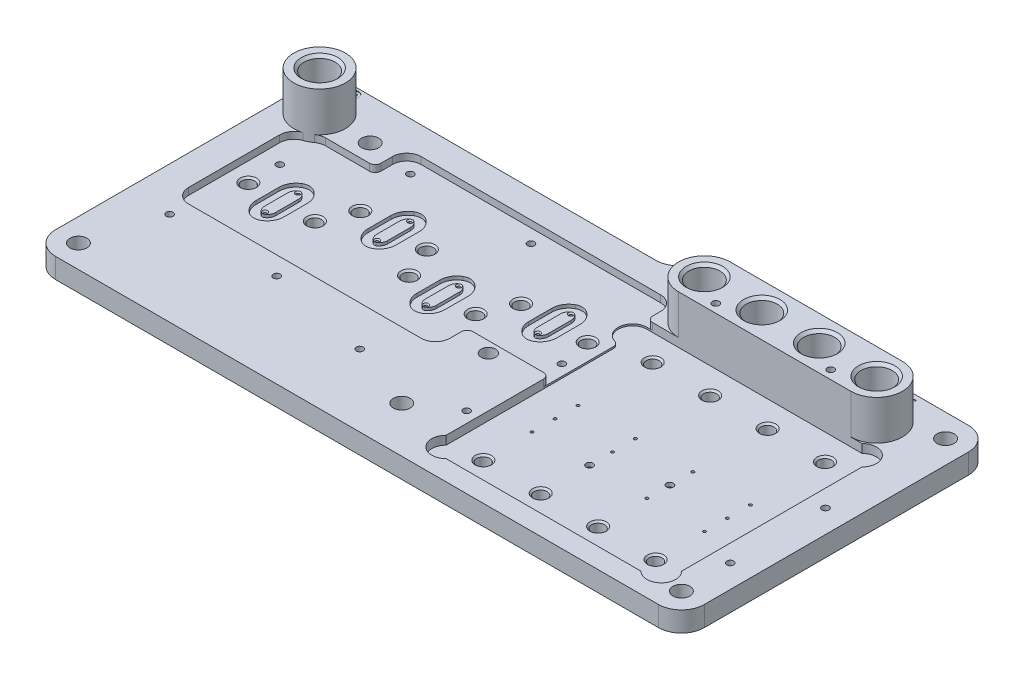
SolidWorks part; units mm, degrees
ref_plane "X_Y" through (0, 0, 0) normal (0, 0, 1) x (1, 0, 0)
ref_plane "Z_X" through (0, 0, 0) normal (0, 1, 0) x (1, 0, 0)
ref_plane "Y_Z" through (0, 0, 0) normal (1, 0, 0) x (0, 0, -1)
ref_plane "X_Y-_6021_master" through (0, 0, 0) normal (0, 0, 1) x (1, 0, 0)
ref_plane "Z_X_peltier-_6021_master" through (0, 0, 0) normal (0, 1, 0) x (1, 0, 0)
ref_plane "Y_Z-_6021_master" through (0, 0, 0) normal (1, 0, 0) x (0, 0, -1)
sketch "zx_sketch-_6021_master" plane through (0, 0, 0) normal (0, 1, 0) x (1, 0, 0)
  line L0 (0, 0) -> (0, 39833.2138) construction
  line L1 (-56.5, 24.66) -> (4, 24.66)
  line L2 (-56.5, 24.66) -> (-56.5, -27)
  line L3 (-56.5, -27) -> (56.5, -27)
  line L4 (56.5, 27) -> (56.5, -27)
  line L5 (0, 0) -> (39833.2138, 0) construction
  line L6 (4, 24.66) -> (4, 27)
  line L11 (4, 27) -> (56.5, 27)
  point P3 (0, -27)
  point P17 (-22.5, 15.66)
  point P18 (22.5, 15.66)
  point P19 (22.5, -15.66)
  point P20 (-22.5, -15.66)
  dimension "D1" = 113
  dimension "D2" = 24.66
  dimension "D3" = 45
  dimension "D4" = 31.32
  dimension "D5" = 27
  dimension "D6" = 2.34
  dimension "D7" = 4
  dimension "D8" = 27
sketch "xy_sketch-_6021_master" plane through (0, 0, 0) normal (0, 0, 1) x (1, 0, 0)
  line L0 (0, 0) -> (0, 5) construction
  line L1 (0, 5) -> (0, 7.3) construction
  dimension "D1" = 5
  dimension "D2" = 2.3
ref_plane "zx_lower_plate-_6021_master" through (0, 5, 0) normal (0, 1, 0) x (1, 0, 0)
ref_plane "zx_sensor-_6021_master" through (0, 7.3, 0) normal (0, 1, 0) x (1, 0, 0)
sketch "zx_sensor_sketch-_6021_master" plane through (0, 7.3, 0) normal (0, 1, 0) x (1, 0, 0)
  line L0 (-42.2, 3.16) -> (-28.2, 8.66) construction
  line L1 (-28.2, 8.66) -> (-14.2, 3.16) construction
  line L2 (-14.2, 3.16) -> (-0.2, 8.66) construction
  line L3 (-42.2, 4.96) -> (-42.2, -0.8) construction
  line L4 (-28.2, 10.46) -> (-28.2, 4.7) construction
  line L5 (-14.2, 4.96) -> (-14.2, -0.8) construction
  line L6 (-0.2, 10.46) -> (-0.2, 4.7) construction
  line L7 (-42.2, 3.16) -> (-42.2, -0.8) construction
  line L8 (-28.2, 8.66) -> (-28.2, 4.7) construction
  line L9 (-14.2, 3.16) -> (-14.2, -0.8) construction
  line L10 (-0.2, 8.66) -> (-0.2, 4.7) construction
  line L11 (-39.215, 3.16) -> (-45.185, 3.16) construction
  line L12 (-39.215, 7.475) -> (-39.215, -1.155) construction
  line L13 (-44.615, 3.16) -> (-39.785, 3.16) construction
  point P8 (-42.2, 2.08)
  point P16 (-42.2, 3.16)
  point P19 (-39.215, 3.16)
  point P22 (-42.2, 3.16)
  dimension "D3" = 14
  dimension "D4" = 1.08
  dimension "D6" = 5.76
  dimension "D7" = 5.97
  dimension "D9" = 8.63
  dimension "D10" = 4.83
  dimension "D11" = 5.5
sketch "zx_valve_sketch-_6021_master" plane through (0, 8.2, 0) normal (0, 1, 0) x (1, 0, 0)
  line L0 (44, -4.25) -> (34, -4.25) construction
  line L1 (34, -4.25) -> (24, -4.25) construction
  line L2 (24, -4.25) -> (14, -4.25) construction
  line L3 (44, -10.5) -> (44, -6.5) construction
  line L4 (44, -6.5) -> (44, -2.5) construction
  line L5 (34, -2.5) -> (34, -6.5) construction
  line L6 (34, -6.5) -> (34, -10.5) construction
  line L7 (24, -2.5) -> (24, -6.5) construction
  line L8 (24, -6.5) -> (24, -10.5) construction
  line L9 (14, -2.5) -> (14, -6.5) construction
  line L10 (14, -6.5) -> (14, -10.5) construction
  line L11 (44, 10.5) -> (44, -19) construction
  line L12 (34, 10.5) -> (34, -19) construction
  line L14 (24, -19) -> (24, 10.5) construction
  line L17 (14, 10.5) -> (14, -19) construction
  point P20 (44, -4.25)
  dimension "D1" = 10
  dimension "D4" = 8
  dimension "D5" = 2.25
  dimension "D6" = 29.5
sketch "zx_manifold_sketch-_6021_master" plane through (0, 5, 0) normal (0, 1, 0) x (1, 0, 0)
  line L0 (-34.0003, 7.58) -> (-22.3997, 7.58) construction
  line L4 (44, 19.5) -> (34, 19.5) construction
  line L5 (34, 19.5) -> (24, 19.5) construction
  line L6 (24, 19.5) -> (14, 19.5) construction
  line L7 (39, 10.5) -> (39, -7.6132)
  line L9 (-48.0003, 2.08) -> (-36.3997, 2.08) construction
  line L11 (-20.0003, 2.08) -> (-8.3997, 2.08) construction
  line L12 (-6.0003, 7.58) -> (5.6003, 7.58) construction
  line L13 (-48.9, -6.72) -> (-2.2958, -6.72)
  line L15 (14, -6.5) -> (24, -6.5)
  line L17 (-14.2, 4.96) -> (-9.7626, 10.5608)
  line L22 (34, -4.7265) -> (44, -4.7265) construction
  line L23 (44, -4.7265) -> (39, -7.6132) construction
  line L24 (-4.2467, 12.0482) -> (-0.2, 10.46)
  line L26 (44, 22) -> (14, 22)
  line L28 (-48.9, -14.72) -> (-30.3969, -14.72)
  line L30 (10.8896, -9.015) -> (7.7791, -11.53) construction
  line L31 (34, -14.5) -> (45, -14.5)
  line L32 (-22.5, -24) -> (44, -24)
  line L35 (-14.2, -0.8) -> (-18.2467, -2.3882)
  line L38 (-52.7667, 2.6469) -> (-51, 17.5)
  line L39 (-28.2, 4.7) -> (-23.7626, -0.9008)
  line L40 (14, 10.5) -> (22.5, 15.66) construction
  line L43 (49, -19) -> (49, -18.5)
  line L45 (-32.2467, 12.0482) -> (-28.2, 10.46)
  line L46 (-37.7626, 10.5608) -> (-42.2, 4.96)
  line L47 (-42.2, -0.8) -> (-46.2467, -2.3882)
  line L48 (-0.2, 4.7) -> (10.8896, -9.015)
  circle A0 centre (34, 19.5) radius 3.85 construction
  circle A1 centre (44, 19.5) radius 3.85 construction
  circle A2 centre (24, 19.5) radius 3.85 construction
  circle A3 centre (14, 19.5) radius 3.85 construction
  arc A4 (34, -10.5) -> (39, -7.6132) centre (34, -4.7265) ccw
  arc A6 (29, 10.5) -> (34, -2.5) centre (48.4, 10.5) ccw
  arc A7 (44, -10.5) -> (39, -7.6132) centre (44, -4.7265) cw
  arc A8 (44, -2.5) -> (49, 10.5) centre (29.6, 10.5) ccw
  arc A11 (45.3208, 21.6226) -> (44, 22) centre (44, 19.5) ccw
  arc A12 (44, -6.5) -> (51.5, 10.5) centre (28.4833, 10.5) ccw
  arc A13 (14, 22) -> (11.6636, 20.3896) centre (14, 19.5) ccw
  arc A15 (34, -14.5) -> (34, -6.5) centre (34, -10.5) cw
  arc A16 (-48.9, -6.72) -> (-48.9, -14.72) centre (-48.9, -10.72) ccw
  arc A17 (44, -24) -> (49, -19) centre (44, -19) ccw
  arc A18 (-22.5, -24) -> (-26.4485, -19.36) centre (-22.5, -20) cw
  arc A19 (-30.3969, -14.72) -> (-26.4485, -19.36) centre (-30.3969, -18.72) cw
  arc A20 (14, -10.5) -> (10.8896, -9.015) centre (14, -6.5) cw
  arc A21 (-4.2467, 12.0482) -> (-9.7626, 10.5608) centre (-6.0003, 7.58) ccw
  circle A22 centre (-51, 17.5) radius 3.85 construction
  arc A23 (-23.7626, -0.9008) -> (-18.2467, -2.3882) centre (-20.0003, 2.08) ccw
  arc A24 (-32.2467, 12.0482) -> (-37.7626, 10.5608) centre (-34.0003, 7.58) ccw
  arc A25 (-46.2467, -2.3882) -> (-52.7667, 2.6469) centre (-48.0003, 2.08) cw
  arc A26 (49, -18.5) -> (45, -14.5) centre (45, -18.5) ccw
  circle A27 centre (-51, 17.5) radius 5.5 construction
  arc A29 (14, 19.5) -> (19, 10.5) centre (8.4, 10.5) cw
  arc A30 (39, 10.5) -> (34, 19.5) centre (28.4, 10.5) ccw
  arc A31 (49, 10.5) -> (44, 19.5) centre (38.4, 10.5) ccw
  arc A32 (29, 10.5) -> (24, 19.5) centre (18.4, 10.5) ccw
  arc A33 (19, 10.5) -> (24, -2.5) centre (38.4, 10.5) ccw
  arc A35 (45.3208, 21.6226) -> (51.5, 10.5) centre (38.4, 10.5) cw
  arc A36 (14, -2.5) -> (11.6636, 20.3896) centre (35.6147, 11.2703) cw
  arc A37 (19.5172, -12.2931) -> (7.7791, -11.53) centre (14, -6.5) cw
  arc A38 (7.7791, -11.53) -> (-2.2958, -6.72) centre (-2.2958, -19.6763) ccw
  arc A39 (24, -10.5) -> (19.5172, -12.2931) centre (24, -17) ccw
  point P121 (-42.2, 2.08)
  dimension "D1" = 30
  dimension "D2" = 7.7
  dimension "D4" = 2.5
  dimension "D5" = 4
  dimension "D6" = 92.9
  dimension "D9" = 4
  dimension "D15" = 4
  dimension "D18" = 4.8
  dimension "D11" = 4
sketch "zx_screws_sketch-_6021_master" plane through (0, 5, 0) normal (0, 1, 0) x (1, 0, 0)
  line L4 (-34.0003, 7.58) -> (-22.3997, 7.58) construction
  line L5 (-20.0003, 2.08) -> (-8.3997, 2.08) construction
  line L6 (-6.0003, 7.58) -> (5.6003, 7.58) construction
  line L7 (-36.3997, 2.08) -> (-48.0003, 2.08) construction
  line L13 (56.5, 27) -> (56.5, -27) construction
  circle A0 centre (52.5, 23) radius 4 construction
  circle A3 centre (52.5, -23) radius 4 construction
  arc A7 (-52.7667, 2.6469) -> (-46.2467, -2.3882) centre (-48.0003, 2.08) ccw construction
  circle A8 centre (-52.5, -23) radius 4 construction
  point P0 (-0.2, -19)
  point P1 (52.5, -23)
  point P2 (52.5, 23)
  point P3 (6.6, 23)
  point P4 (-52.5, -23)
  point P5 (-42.2, 17.5)
ref_plane "yz_sensor-_6021_master" through (-42.2, 0, 0) normal (1, 0, 0) x (0, 0, -1)
ref_plane "zx_valve-_6021_master" through (0, 8.2, 0) normal (0, 1, 0) x (1, 0, 0)
ref_plane "zx_sensor_shelf-_6021_master" through (0, 9.691, 0) normal (0, 1, 0) x (1, 0, 0)
sketch "xz_cover-_6021_master" plane through (0, 0, 0) normal (0, 1, 0) x (1, 0, 0)
  line L1 (-63, -36.79) -> (63, -36.79)
  line L2 (-71.85, -27.94) -> (-71.85, 30.02)
  line L3 (-71.85, 30.02) -> (71.85, 30.02)
  line L4 (71.85, -27.94) -> (71.85, 30.02)
  line L5 (-71.85, -36.79) -> (71.85, 30.02) construction
  line L6 (-71.85, 30.02) -> (71.85, -36.79) construction
  line L7 (0, -1003.385) -> (0, 48996.615) construction
  arc A0 (71.85, -27.94) -> (63, -36.79) centre (63, -27.94) cw
  arc A1 (-63, -36.79) -> (-71.85, -27.94) centre (-63, -27.94) cw
  circle A2 centre (-64.495, 5.21) radius 3.6
  circle A3 centre (64.495, 5.21) radius 3.6
  point P0 (0, -3.385)
  dimension "D4" = 8.85
  dimension "D5" = 42
  dimension "D7" = 7.2
  dimension "D1" = 66.81
  dimension "D2" = 143.7
  dimension "D6" = 128.99
inserted part "_6021_master"
sketch "Sketch7" plane through (0, 5, 0) normal (0, 1, 0) x (1, 0, 0)
  line L0 (-56.5, -27) -> (56.5, -27) construction
  line L1 (56.5, 27) -> (56.5, -27) construction
  line L2 (4, 27) -> (56.5, 27) construction
  line L3 (4, 24.66) -> (4, 27) construction
  line L4 (-56.5, 24.66) -> (4, 24.66) construction
  line L5 (-56.5, 24.66) -> (-56.5, -27) construction
  line L6 (-56.5, -27) -> (56.5, -27)
  line L7 (56.5, 27) -> (56.5, -27)
  line L8 (4, 27) -> (56.5, 27)
  line L9 (4, 24.66) -> (4, 27)
  line L10 (-56.5, 24.66) -> (4, 24.66)
  line L11 (-56.5, 24.66) -> (-56.5, -27)
  circle A0 centre (-42.2, 4.96) radius 0.25
  circle A1 centre (-42.2, -0.8) radius 0.25
  circle A2 centre (-28.2, 10.46) radius 0.25
  circle A3 centre (-28.2, 4.7) radius 0.25
  circle A4 centre (-14.2, 4.96) radius 0.25
  circle A5 centre (-14.2, -0.8) radius 0.25
  circle A6 centre (-0.2, 10.46) radius 0.25
  circle A7 centre (-0.2, 4.7) radius 0.25
  circle A8 centre (14, -2.5) radius 0.25
  circle A9 centre (14, -6.5) radius 0.25
  circle A10 centre (14, -10.5) radius 0.25
  circle A11 centre (24, -2.5) radius 0.25
  circle A12 centre (24, -6.5) radius 0.25
  circle A13 centre (24, -10.5) radius 0.6
  circle A14 centre (34, -2.5) radius 0.25
  circle A15 centre (34, -6.5) radius 0.6
  circle A16 centre (34, -10.5) radius 0.25
  circle A17 centre (44, -2.5) radius 0.25
  circle A18 centre (44, -6.5) radius 0.25
  circle A19 centre (44, -10.5) radius 0.25
  circle A20 centre (-51, 17.5) radius 0.25
  circle A21 centre (14, 19.5) radius 0.25
  circle A22 centre (24, 19.5) radius 0.25
  circle A23 centre (34, 19.5) radius 0.25
  circle A24 centre (44, 19.5) radius 0.25
  dimension "D1" = 0.5
  dimension "D2" = 0.5
  dimension "D3" = 1.2
extrude "Boss-Extrude1" add sketch "Sketch7" along normal up to surface (2.3 mm away)
sketch "Sketch8" plane through (0, 7.3, 0) normal (0, 1, 0) x (1, 0, 0)
  line L2 (14, 24) -> (44, 24)
  line L3 (14, 15) -> (44, 15)
  circle A0 centre (-51, 17.5) radius 4.5
  arc A1 (14, 24) -> (14, 15) centre (14, 19.5) ccw
  arc A2 (44, 24) -> (44, 15) centre (44, 19.5) cw
  circle A3 centre (44, 19.5) radius 0.25 construction
  circle A4 centre (34, 19.5) radius 0.25 construction
  circle A5 centre (24, 19.5) radius 0.25 construction
  circle A6 centre (14, 19.5) radius 0.25 construction
  circle A7 centre (-51, 17.5) radius 0.25 construction
  circle A8 centre (44, 19.5) radius 0.25
  circle A9 centre (34, 19.5) radius 0.25
  circle A10 centre (24, 19.5) radius 0.25
  circle A11 centre (14, 19.5) radius 0.25
  circle A12 centre (-51, 17.5) radius 0.25
  dimension "D1" = 9
extrude "Boss-Extrude2" add sketch "Sketch8" along normal blind 8.1
sketch "Sketch17" plane through (0, 7.3, 0) normal (0, 1, 0) x (1, 0, 0)
  line L0 (-34.0003, 7.58) -> (-22.3997, 7.58) construction
  line L1 (8.5, 15) -> (49.5, 15)
  line L2 (8.5, -2.02) -> (8.5, -23.5)
  line L3 (8.5, -23.5) -> (49.5, -23.5)
  line L4 (49.5, 15) -> (49.5, -23.5)
  line L5 (-5.8, -7.52) -> (-51.3003, -7.52)
  line L6 (-51.3003, -7.52) -> (-51.3003, 14.38)
  line L7 (-51.3003, 14.38) -> (-38.2, 14.38)
  line L8 (-38.2, 14.38) -> (-38.2, 19.88)
  line L9 (-38.2, 19.88) -> (8.5, 19.88)
  line L10 (-48.0003, 2.08) -> (-36.3997, 2.08) construction
  line L11 (34, -4.25) -> (24, -4.25) construction
  line L12 (-5.8, -7.52) -> (-5.8, -2.02)
  line L13 (-5.8, -2.02) -> (8.5, -2.02)
  line L15 (-20.0003, 2.08) -> (-8.3997, 2.08) construction
  line L16 (4, 24.66) -> (-56.5, 24.66)
  line L17 (-56.5, 24.66) -> (-56.5, -27)
  line L18 (-56.5, -27) -> (56.5, -27)
  line L19 (56.5, -27) -> (56.5, 27)
  line L20 (56.5, 27) -> (4, 27)
  line L21 (4, 27) -> (4, 24.66)
  line L22 (4, 24.66) -> (-56.5, 24.66)
  line L23 (-56.5, 24.66) -> (-56.5, -27)
  line L24 (-56.5, -27) -> (56.5, -27)
  line L25 (56.5, -27) -> (56.5, 27)
  line L26 (56.5, 27) -> (4, 27)
  line L27 (4, 27) -> (4, 24.66)
  line L28 (-36.3997, 2.08) -> (-36.3997, 7.58) construction
  line L30 (8.5, 19.88) -> (8.5, 15)
  line L31 (14, 15) -> (44, 15) construction
  circle A0 centre (44, -2.5) radius 0.25 construction
  circle A1 centre (34, -2.5) radius 0.25 construction
  circle A2 centre (24, -2.5) radius 0.25 construction
  circle A3 centre (14, -2.5) radius 0.25 construction
  circle A4 centre (44, -2.5) radius 0.25
  circle A5 centre (34, -2.5) radius 0.25
  circle A6 centre (24, -2.5) radius 0.25
  circle A7 centre (14, -2.5) radius 0.25
  circle A8 centre (44, -6.5) radius 0.25 construction
  circle A9 centre (34, -6.5) radius 0.6 construction
  circle A10 centre (24, -6.5) radius 0.25 construction
  circle A11 centre (14, -6.5) radius 0.25 construction
  circle A12 centre (44, -6.5) radius 0.25
  circle A13 centre (34, -6.5) radius 0.6
  circle A14 centre (24, -6.5) radius 0.25
  circle A15 centre (14, -6.5) radius 0.25
  circle A16 centre (44, -10.5) radius 0.25 construction
  circle A17 centre (34, -10.5) radius 0.25 construction
  circle A18 centre (24, -10.5) radius 0.6 construction
  circle A19 centre (14, -10.5) radius 0.25 construction
  circle A20 centre (44, -10.5) radius 0.25
  circle A21 centre (34, -10.5) radius 0.25
  circle A22 centre (24, -10.5) radius 0.6
  circle A23 centre (14, -10.5) radius 0.25
  circle A27 centre (44, 19.5) radius 0.25 construction
  circle A28 centre (34, 19.5) radius 0.25 construction
  circle A29 centre (24, 19.5) radius 0.25 construction
  circle A30 centre (14, 19.5) radius 0.25 construction
  circle A31 centre (-51, 17.5) radius 0.25 construction
  circle A32 centre (44, 19.5) radius 0.25
  circle A33 centre (34, 19.5) radius 0.25
  circle A34 centre (24, 19.5) radius 0.25
  circle A35 centre (14, 19.5) radius 0.25
  circle A36 centre (-51, 17.5) radius 0.25
  point P51 (29, -23.5)
  point P60 (29, -4.25)
  point P64 (49.5, -4.25)
  point P65 (-28.2, 7.58)
  point P71 (-14.2, 2.08)
  dimension "D1" = 38.5
  dimension "D2" = 41
  dimension "D3" = 0
  dimension "D5" = 9.6
  dimension "D6" = 12.3
  dimension "D7" = 3.3
  dimension "D8" = 10
  dimension "D10" = 8.4
extrude "Boss-Extrude3" add sketch "Sketch17" along normal blind 1.2 contours L8 L9 L1 L4 L3 L2 L5 L6 L7 M8 M3 M4 M5 M6 M7 M31 M32 M33 M29
hole_wizard "1/4-28 Tapped Hole1" positions "Sketch9" profile "Sketch10" tap size "1/4-28" standard "ANSI Inch"
sketch "Sketch9" plane through (0, 15.4, 0) normal (0, 1, 0) x (1, 0, 0)
  point P0 (-51, 17.5)
  point P3 (14, 19.5)
  point P6 (24, 19.5)
  point P9 (34, 19.5)
  point P12 (44, 19.5)
sketch "Sketch10" plane through (-51, 15.4, -17.5) normal (1, 0, 0) x (0, 0, 1)
  line L0 (0, 0) -> (0, 8.89)
  line L1 (0, 8.89) -> (2.7051, 8.89)
  line L2 (2.7051, 8.89) -> (2.7051, 0.4699)
  line L3 (2.7051, 0.4699) -> (3.175, 0)
  line L5 (3.175, 0) -> (0, 0)
  line L6 (-2.7051, 0.4699) -> (-3.175, 0) construction
  line L10 (0, 8.89) -> (-2.7051, 8.89) construction
  line L11 (0, -6.35) -> (0, 107.95) construction
  dimension "Tap Drill Dia." = 5.4102
  dimension "Tap Drill Depth" = 8.89
  dimension "Near C'Sink Dia." = 6.35
  dimension "Near C'Sink Angle" = 90
  dimension "Drill Angle" = 180
sketch "Sketch29" plane through (0, 7.3, 0) normal (0, 1, 0) x (1, 0, 0)
  line L0 (8.5, -2.02) -> (8.5, -23.5) construction
  line L1 (8.5, -23.5) -> (49.5, -23.5) construction
  line L2 (49.5, 15) -> (49.5, -23.5) construction
  line L3 (8.5, 15) -> (49.5, 15) construction
  line L4 (8.5, 15) -> (8.5, -23.5)
  line L5 (8.5, -23.5) -> (49.5, -23.5)
  line L6 (49.5, 15) -> (49.5, -23.5)
  line L7 (8.5, 15) -> (49.5, 15)
extrude "Cut-Extrude1" cut sketch "Sketch29" against normal blind 0.3
hole_wizard "#4 (0.209) Diameter Hole1" positions "Sketch11" profile "Sketch12" hole size "#4" standard "ANSI Inch"
sketch "Sketch11" plane through (0, 8.5, 0) normal (0, 1, 0) x (1, 0, 0)
  point P0 (-42.2, 17.5)
  point P3 (-52.5, -23)
  point P6 (-0.2, -19)
  point P9 (6.6, 23)
  point P12 (52.5, 23)
  point P15 (52.5, -23)
sketch "Sketch12" plane through (-42.2, 8.5, -17.5) normal (1, 0, 0) x (0, 0, 1)
  line L0 (0, 0) -> (0, 3.5)
  line L1 (0, 3.5) -> (1.4732, 3.5)
  line L2 (1.4732, 3.5) -> (1.4732, 0)
  line L5 (1.4732, 0) -> (0, 0)
  line L11 (0, -6.35) -> (0, 107.95) construction
  dimension "Thru Hole Dia." = 2.9464
  dimension "Thru Hole Depth" = 3.5
hole_wizard "#4-40 Tapped Hole1" positions "Sketch13" profile "Sketch14" tap size "#4-40" standard "ANSI Inch"
sketch "Sketch13" plane through (0, 7.3, 0) normal (0, 1, 0) x (1, 0, 0)
  point P0 (-48.0003, 2.08)
  point P3 (-36.3997, 2.08)
  point P6 (-34.0003, 7.58)
  point P9 (-22.3997, 7.58)
  point P12 (-20.0003, 2.08)
  point P15 (-8.3997, 2.08)
  point P18 (-6.0003, 7.58)
  point P21 (5.6003, 7.58)
sketch "Sketch14" plane through (-48.0003, 7.3, -2.08) normal (1, 0, 0) x (0, 0, 1)
  line L0 (0, 0) -> (0, 2.3)
  line L1 (0, 2.3) -> (1.1303, 2.3)
  line L2 (1.1303, 2.3) -> (1.1303, 0.2921)
  line L3 (1.1303, 0.2921) -> (1.4224, 0)
  line L5 (1.4224, 0) -> (0, 0)
  line L6 (-1.1303, 0.2921) -> (-1.4224, 0) construction
  line L11 (0, -6.35) -> (0, 107.95) construction
  dimension "Thru Tap Drill Dia." = 2.2606
  dimension "Thru Tap Drill Depth" = 2.3
  dimension "Near C'Sink Dia." = 2.8448
  dimension "Near C'Sink Angle" = 90
hole_wizard "#4-40 Tapped Hole2" positions "Sketch18" profile "Sketch19" tap size "#4-40" standard "ANSI Inch"
sketch "Sketch18" plane through (0, 7, 0) normal (0, 1, 0) x (1, 0, 0)
  point P0 (14, 10.5)
  point P3 (24, 10.5)
  point P6 (34, 10.5)
  point P9 (44, 10.5)
  point P12 (14, -19)
  point P15 (24, -19)
  point P18 (34, -19)
  point P21 (44, -19)
sketch "Sketch19" plane through (14, 7, -10.5) normal (1, 0, 0) x (0, 0, 1)
  line L0 (0, 0) -> (0, 2)
  line L1 (0, 2) -> (1.1303, 2)
  line L2 (1.1303, 2) -> (1.1303, 0.2921)
  line L3 (1.1303, 0.2921) -> (1.4224, 0)
  line L5 (1.4224, 0) -> (0, 0)
  line L6 (-1.1303, 0.2921) -> (-1.4224, 0) construction
  line L11 (0, -6.35) -> (0, 107.95) construction
  dimension "Thru Tap Drill Dia." = 2.2606
  dimension "Thru Tap Drill Depth" = 2
  dimension "Near C'Sink Dia." = 2.8448
  dimension "Near C'Sink Angle" = 90
sketch "Sketch15" plane through (0, 7.3, 0) normal (0, 1, 0) x (1, 0, 0)
  line L1 (-42.2, 4.96) -> (-42.2, -0.8) construction
  line L2 (-46.025, 2.08) -> (-45.0281, 2.08) construction
  line L7 (-41.25, 4.094) -> (-41.25, 0.066)
  line L8 (-43.15, 4.094) -> (-43.15, 0.066)
  line L9 (-42.7, 4.094) -> (-42.2, 4.96) construction
  line L10 (-42.2, 4.96) -> (-42.45, 4.96) construction
  arc A0 (-42.425, 5.3497) -> (-41.975, 5.3497) centre (-42.2, 4.96) cw
  circle A1 centre (-42.2, 4.96) radius 0.25 construction
  arc A2 (-42.425, 5.3497) -> (-43.15, 4.094) centre (-41.7, 4.094) ccw
  arc A3 (-41.975, 5.3497) -> (-41.25, 4.094) centre (-42.7, 4.094) cw
  arc A4 (-41.975, -1.1897) -> (-41.25, 0.066) centre (-42.7, 0.066) ccw
  arc A5 (-42.425, -1.1897) -> (-43.15, 0.066) centre (-41.7, 0.066) cw
  arc A6 (-42.425, -1.1897) -> (-41.975, -1.1897) centre (-42.2, -0.8) ccw
  point P12 (-42.2, 2.08)
  dimension "D1" = 1.9
  dimension "D3" = 0.2
  dimension "D2" = 60
extrude "flowcell_cut" cut sketch "Sketch15" against normal blind 0.1
chamfer "Chamfer1" distance 0.2 angle 45 2 edges at (-42.2, 7.2, 0.55) (-42.2, 7.2, -5.21)
sketch "Sketch16" plane through (0, 7.3, 0) normal (0, 1, 0) x (1, 0, 0)
  line L2 (-41.25, 0.066) -> (-41.25, 4.094)
  line L3 (-43.15, 4.094) -> (-43.15, 0.066)
  line L8 (-41.25, 0.066) -> (-41.25, 4.094)
  line L9 (-43.15, 4.094) -> (-43.15, 0.066)
  line L64 (-39.75, 0.066) -> (-39.75, 4.094)
  line L65 (-44.65, 4.094) -> (-44.65, 0.066)
  line L66 (-39.75, 0.066) -> (-39.75, 4.094)
  line L67 (-44.65, 4.094) -> (-44.65, 0.066)
  arc A6 (-41.25, 4.094) -> (-41.975, 5.3497) centre (-42.7, 4.094) ccw
  arc A7 (-41.975, -1.1897) -> (-41.25, 0.066) centre (-42.7, 0.066) ccw
  arc A8 (-42.425, -1.1897) -> (-41.975, -1.1897) centre (-42.2, -0.8) ccw
  arc A9 (-43.15, 0.066) -> (-42.425, -1.1897) centre (-41.7, 0.066) ccw
  arc A10 (-42.425, 5.3497) -> (-43.15, 4.094) centre (-41.7, 4.094) ccw
  arc A11 (-42.425, -1.1897) -> (-41.975, -1.1897) centre (-42.2, -0.8) ccw
  arc A24 (-41.25, 4.094) -> (-41.975, 5.3497) centre (-42.7, 4.094) ccw
  arc A25 (-41.975, -1.1897) -> (-41.25, 0.066) centre (-42.7, 0.066) ccw
  arc A27 (-43.15, 0.066) -> (-42.425, -1.1897) centre (-41.7, 0.066) ccw
  arc A28 (-42.425, 5.3497) -> (-43.15, 4.094) centre (-41.7, 4.094) ccw
  arc A30 (-39.75, 4.094) -> (-41.225, 6.6487) centre (-42.7, 4.094) ccw
  arc A31 (-41.225, -2.4887) -> (-39.75, 0.066) centre (-42.7, 0.066) ccw
  arc A32 (-43.175, -2.4887) -> (-41.225, -2.4887) centre (-42.2, -0.8) ccw
  arc A33 (-44.65, 0.066) -> (-43.175, -2.4887) centre (-41.7, 0.066) ccw
  arc A34 (-43.175, 6.6487) -> (-44.65, 4.094) centre (-41.7, 4.094) ccw
  arc A35 (-43.175, -2.4887) -> (-41.225, -2.4887) centre (-42.2, -0.8) ccw
  arc A36 (-39.75, 4.094) -> (-41.225, 6.6487) centre (-42.7, 4.094) ccw
  arc A37 (-41.225, -2.4887) -> (-39.75, 0.066) centre (-42.7, 0.066) ccw
  arc A39 (-44.65, 0.066) -> (-43.175, -2.4887) centre (-41.7, 0.066) ccw
  arc A40 (-43.175, 6.6487) -> (-44.65, 4.094) centre (-41.7, 4.094) ccw
  arc A44 (-41.225, 6.6487) -> (-43.175, 6.6487) centre (-42.2, 4.96) ccw
  arc A45 (-41.225, 6.6487) -> (-43.175, 6.6487) centre (-42.2, 4.96) ccw
  arc A46 (-41.975, 5.3497) -> (-42.425, 5.3497) centre (-42.2, 4.96) ccw
  arc A47 (-41.975, 5.3497) -> (-42.425, 5.3497) centre (-42.2, 4.96) ccw
  dimension "D2" = 0
  dimension "D4" = 1.5
extrude "gland_cut" cut sketch "Sketch16" against normal blind 0.6
pattern_linear "LPattern17" count 4 spacing 14 along (1, 0, 0) count 2 spacing 5.5 of "gland_cut", "flowcell_cut"
pattern_linear "LPattern19" count 4 spacing 14 along (1, 0, 0) count 2 spacing 5.5 of "Chamfer1"
sketch "Sketch20" plane through (0, 5, 0) normal (0, -1, 0) x (1, 0, 0)
  line L2 (10.6952, 9.1722) -> (-0.3944, -4.5428)
  line L3 (10.6952, 9.1722) -> (-0.3944, -4.5428)
  line L4 (-42.396, -5.1152) -> (-37.9586, -10.716)
  line L5 (-32.1553, -12.2809) -> (-28.1087, -10.6927)
  line L6 (-42.396, -5.1152) -> (-37.9586, -10.716)
  line L7 (-32.1553, -12.2809) -> (-28.1087, -10.6927)
  line L8 (-42.004, -4.8048) -> (-37.5667, -10.4055)
  line L9 (-32.338, -11.8155) -> (-28.2913, -10.2273)
  line L10 (-42.004, -4.8048) -> (-37.5667, -10.4055)
  line L11 (-32.338, -11.8155) -> (-28.2913, -10.2273)
  line L12 (11.084, 8.8578) -> (-0.0056, -4.8572)
  line L13 (11.084, 8.8578) -> (-0.0056, -4.8572)
  line L14 (-18.338, 2.1555) -> (-14.2913, 0.5673)
  line L15 (-28.004, -4.8552) -> (-23.5667, 0.7455)
  line L16 (-18.338, 2.1555) -> (-14.2913, 0.5673)
  line L17 (-28.004, -4.8552) -> (-23.5667, 0.7455)
  line L18 (-18.1553, 2.6209) -> (-14.1087, 1.0327)
  line L19 (-28.396, -4.5448) -> (-23.9586, 1.056)
  line L20 (-18.1553, 2.6209) -> (-14.1087, 1.0327)
  line L21 (-28.396, -4.5448) -> (-23.9586, 1.056)
  line L23 (-42.396, -5.1152) -> (-42.004, -4.8048)
  line L24 (-4.1553, -12.2809) -> (-0.1087, -10.6927)
  line L25 (-14.396, -5.1152) -> (-9.9586, -10.716)
  line L26 (-4.1553, -12.2809) -> (-0.1087, -10.6927)
  line L27 (-14.396, -5.1152) -> (-9.9586, -10.716)
  line L28 (-4.338, -11.8155) -> (-0.2913, -10.2273)
  line L29 (-14.004, -4.8048) -> (-9.5667, -10.4055)
  line L30 (-4.338, -11.8155) -> (-0.2913, -10.2273)
  line L31 (-14.004, -4.8048) -> (-9.5667, -10.4055)
  line L36 (-28.1087, -10.6927) -> (-28.2913, -10.2273)
  line L37 (-28.004, -4.8552) -> (-28.396, -4.5448)
  line L38 (-14.2913, 0.5673) -> (-14.1087, 1.0327)
  line L39 (-14.396, -5.1152) -> (-14.004, -4.8048)
  line L40 (-0.1087, -10.6927) -> (-0.2913, -10.2273)
  line L41 (-0.0056, -4.8572) -> (-0.3944, -4.5428)
  line L42 (14, 10.25) -> (14, 10.75)
  arc A2 (-37.9586, -10.716) -> (-32.1553, -12.2809) centre (-34.0003, -7.58) ccw
  arc A3 (-37.9586, -10.716) -> (-32.1553, -12.2809) centre (-34.0003, -7.58) ccw
  arc A4 (-37.5667, -10.4055) -> (-32.338, -11.8155) centre (-34.0003, -7.58) ccw
  arc A5 (-37.5667, -10.4055) -> (-32.338, -11.8155) centre (-34.0003, -7.58) ccw
  arc A7 (-18.338, 2.1555) -> (-23.5667, 0.7455) centre (-20.0003, -2.08) ccw
  arc A8 (-18.338, 2.1555) -> (-23.5667, 0.7455) centre (-20.0003, -2.08) ccw
  arc A9 (-18.1553, 2.6209) -> (-23.9586, 1.056) centre (-20.0003, -2.08) ccw
  arc A10 (-18.1553, 2.6209) -> (-23.9586, 1.056) centre (-20.0003, -2.08) ccw
  arc A11 (14, 10.75) -> (10.6952, 9.1722) centre (14, 6.5) ccw
  arc A12 (-9.9586, -10.716) -> (-4.1553, -12.2809) centre (-6.0003, -7.58) ccw
  arc A13 (-9.9586, -10.716) -> (-4.1553, -12.2809) centre (-6.0003, -7.58) ccw
  arc A14 (-9.5667, -10.4055) -> (-4.338, -11.8155) centre (-6.0003, -7.58) ccw
  arc A15 (-9.5667, -10.4055) -> (-4.338, -11.8155) centre (-6.0003, -7.58) ccw
  arc A16 (14, 10.75) -> (10.6952, 9.1722) centre (14, 6.5) ccw
  arc A17 (14, 10.25) -> (11.084, 8.8578) centre (14, 6.5) ccw
  arc A19 (14, 10.25) -> (11.084, 8.8578) centre (14, 6.5) ccw
  dimension "D1" = 0.25
  dimension "D2" = 0.25
  dimension "D3" = 0.25
  dimension "D4" = 0.25
  dimension "D5" = 0.25
  dimension "D6" = 0.25
  dimension "D7" = 0.25
  dimension "D8" = 0.25
extrude "manifold_cut1" cut sketch "Sketch20" against normal blind 0.5
sketch "Sketch21" plane through (0, 5, 0) normal (0, -1, 0) x (1, 0, 0)
  line L0 (14, 2.5) -> (14, 6.5) construction
  line L1 (24, 6.5) -> (24, 10.5) construction
  line L2 (14, 6.25) -> (24, 6.25)
  line L3 (14, 6.25) -> (14, 6.75)
  line L4 (-53.015, -2.6765) -> (-51.2483, -17.5295)
  line L5 (-42.1087, 1.0327) -> (-46.1553, 2.6209)
  line L6 (-53.015, -2.6765) -> (-51.2483, -17.5295)
  line L7 (-42.1087, 1.0327) -> (-46.1553, 2.6209)
  line L8 (-52.5185, -2.6174) -> (-50.7517, -17.4705)
  line L9 (-42.2913, 0.5673) -> (-46.338, 2.1555)
  line L10 (-52.5185, -2.6174) -> (-50.7517, -17.4705)
  line L11 (-42.2913, 0.5673) -> (-46.338, 2.1555)
  line L12 (14, 6.75) -> (24, 6.75)
  line L13 (24, 6.25) -> (24, 6.75)
  line L22 (-51.2483, -17.5295) -> (-50.7517, -17.4705)
  line L23 (39.25, -10.5) -> (39.25, 7.5455)
  line L24 (39.25, -10.5) -> (39.25, 7.5455)
  line L25 (38.75, -10.5) -> (38.75, 7.6795)
  line L26 (38.75, -10.5) -> (38.75, 7.5455)
  line L27 (-42.2, 0.8) -> (-46.2467, 2.3882) construction
  line L28 (13.7892, 2.6343) -> (14.2108, 2.3657)
  line L29 (14.1321, -19.7123) -> (13.8679, -19.2877)
  line L30 (23.8144, 2.6675) -> (24.1856, 2.3325)
  line L31 (34.1856, 2.3325) -> (33.8144, 2.6675)
  line L32 (24.1321, -19.7123) -> (23.8679, -19.2877)
  line L33 (34.1321, -19.7123) -> (33.8679, -19.2877)
  line L34 (44.1321, -19.7123) -> (43.8679, -19.2877)
  line L35 (34, 10.25) -> (34, 10.75)
  line L36 (44, 10.25) -> (44, 10.75)
  line L38 (43.8144, 2.3325) -> (44.1856, 2.6675)
  line L41 (44.1685, 6.6846) -> (43.8315, 6.3154)
  line L43 (14, -22.25) -> (44, -22.25)
  line L44 (14, -22.25) -> (44, -22.25)
  line L45 (14, -21.75) -> (44, -21.75)
  line L46 (14, -21.75) -> (44, -21.75)
  arc A0 (14, 2.5) -> (11.6636, -20.3896) centre (35.6147, -11.2703) ccw construction
  arc A2 (-46.1553, 2.6209) -> (-53.015, -2.6765) centre (-48.0003, -2.08) ccw
  arc A3 (-46.1553, 2.6209) -> (-53.015, -2.6765) centre (-48.0003, -2.08) ccw
  arc A4 (-46.338, 2.1555) -> (-52.5185, -2.6174) centre (-48.0003, -2.08) ccw
  arc A5 (-46.338, 2.1555) -> (-52.5185, -2.6174) centre (-48.0003, -2.08) ccw
  circle A8 centre (-42.2, 0.8) radius 0.25 construction
  arc A15 (24.1856, 2.3325) -> (19.25, -10.5) centre (38.4, -10.5) ccw
  arc A16 (14.1321, -19.7123) -> (19.25, -10.5) centre (8.4, -10.5) ccw
  arc A41 (24.1856, 2.3325) -> (19.25, -10.5) centre (38.4, -10.5) ccw
  arc A42 (14.1321, -19.7123) -> (19.25, -10.5) centre (8.4, -10.5) ccw
  arc A43 (23.8144, 2.6675) -> (18.75, -10.5) centre (38.4, -10.5) ccw
  arc A44 (13.8679, -19.2877) -> (18.75, -10.5) centre (8.4, -10.5) ccw
  arc A45 (23.8144, 2.6675) -> (18.75, -10.5) centre (38.4, -10.5) ccw
  arc A46 (13.8679, -19.2877) -> (18.75, -10.5) centre (8.4, -10.5) ccw
  arc A48 (39, 8.0855) -> (34, 10.75) centre (34, 4.7265) ccw
  arc A49 (23.8679, -19.2877) -> (28.75, -10.5) centre (18.4, -10.5) ccw
  arc A50 (33.8144, 2.6675) -> (28.75, -10.5) centre (48.4, -10.5) ccw
  arc A51 (23.8679, -19.2877) -> (28.75, -10.5) centre (18.4, -10.5) ccw
  arc A52 (33.8144, 2.6675) -> (28.75, -10.5) centre (48.4, -10.5) ccw
  arc A53 (24.1321, -19.7123) -> (29.25, -10.5) centre (18.4, -10.5) ccw
  arc A54 (34.1856, 2.3325) -> (29.25, -10.5) centre (48.4, -10.5) ccw
  arc A55 (24.1321, -19.7123) -> (29.25, -10.5) centre (18.4, -10.5) ccw
  arc A56 (34.1856, 2.3325) -> (29.25, -10.5) centre (48.4, -10.5) ccw
  arc A57 (38.75, 7.5455) -> (34, 10.25) centre (34, 4.7265) ccw
  arc A61 (51.75, -10.5) -> (44.1685, 6.6846) centre (28.4833, -10.5) ccw
  arc A62 (44, 10.25) -> (39.25, 7.5455) centre (44, 4.7265) ccw
  arc A63 (34.1321, -19.7123) -> (39.25, -10.5) centre (28.4, -10.5) ccw
  arc A64 (44, 10.25) -> (39.25, 7.5455) centre (44, 4.7265) ccw
  arc A65 (34.1321, -19.7123) -> (39.25, -10.5) centre (28.4, -10.5) ccw
  arc A66 (44, 10.75) -> (38.75, 7.6795) centre (44, 4.7265) ccw
  arc A67 (33.8679, -19.2877) -> (38.75, -10.5) centre (28.4, -10.5) ccw
  arc A68 (44, 10.75) -> (39, 8.0855) centre (44, 4.7265) ccw
  arc A69 (33.8679, -19.2877) -> (38.75, -10.5) centre (28.4, -10.5) ccw
  arc A74 (45.4528, -21.8349) -> (51.75, -10.5) centre (38.4, -10.5) ccw
  arc A75 (-42.2913, 0.5673) -> (-42.1087, 1.0327) centre (-42.2, 0.8) ccw
  arc A76 (44, -22.25) -> (45.4528, -21.8349) centre (44, -19.5) ccw
  arc A77 (44.1321, -19.7123) -> (49.25, -10.5) centre (38.4, -10.5) ccw
  arc A78 (49.25, -10.5) -> (44.1856, 2.6675) centre (29.6, -10.5) ccw
  arc A79 (44.1321, -19.7123) -> (49.25, -10.5) centre (38.4, -10.5) ccw
  arc A80 (49.25, -10.5) -> (44.1856, 2.6675) centre (29.6, -10.5) ccw
  arc A81 (43.8679, -19.2877) -> (48.75, -10.5) centre (38.4, -10.5) ccw
  arc A82 (48.75, -10.5) -> (43.8144, 2.3325) centre (29.6, -10.5) ccw
  arc A83 (43.8679, -19.2877) -> (48.75, -10.5) centre (38.4, -10.5) ccw
  arc A84 (48.75, -10.5) -> (43.8144, 2.3325) centre (29.6, -10.5) ccw
  arc A85 (11.43, -20.4785) -> (14, -22.25) centre (14, -19.5) ccw
  arc A86 (13.7892, 2.6343) -> (11.43, -20.4785) centre (35.6147, -11.2703) ccw
  arc A87 (51.75, -10.5) -> (44.1685, 6.6846) centre (28.4833, -10.5) ccw
  arc A88 (45.4528, -21.8349) -> (51.75, -10.5) centre (38.4, -10.5) ccw
  arc A89 (44, -22.25) -> (45.4528, -21.8349) centre (44, -19.5) ccw
  arc A90 (11.43, -20.4785) -> (14, -22.25) centre (14, -19.5) ccw
  arc A91 (13.7892, 2.6343) -> (11.43, -20.4785) centre (35.6147, -11.2703) ccw
  arc A92 (51.25, -10.5) -> (43.8315, 6.3154) centre (28.4833, -10.5) ccw
  arc A93 (45.1887, -21.4104) -> (51.25, -10.5) centre (38.4, -10.5) ccw
  arc A94 (44, -21.75) -> (45.1887, -21.4104) centre (44, -19.5) ccw
  arc A95 (11.8973, -20.3006) -> (14, -21.75) centre (14, -19.5) ccw
  arc A96 (14.2108, 2.3657) -> (11.8973, -20.3006) centre (35.6147, -11.2703) ccw
  arc A97 (51.25, -10.5) -> (43.8315, 6.3154) centre (28.4833, -10.5) ccw
  arc A98 (45.1887, -21.4104) -> (51.25, -10.5) centre (38.4, -10.5) ccw
  arc A99 (44, -21.75) -> (45.1887, -21.4104) centre (44, -19.5) ccw
  arc A100 (11.8973, -20.3006) -> (14, -21.75) centre (14, -19.5) ccw
  arc A101 (14.2108, 2.3657) -> (11.8973, -20.3006) centre (35.6147, -11.2703) ccw
  dimension "D1" = 0.25
  dimension "D2" = 0.25
  dimension "D3" = 0.25
  dimension "D4" = 0.25
  dimension "D5" = 0.25
  dimension "D6" = 0.25
  dimension "D7" = 0.25
  dimension "D8" = 0.25
  dimension "D9" = 0.25
  dimension "D10" = 0.25
  dimension "D13" = 0.25
  dimension "D14" = 0.25
extrude "manifold_cut2" cut sketch "Sketch21" against normal blind 0.5
sketch "Sketch22" plane through (0, 5, 0) normal (0, -1, 0) x (1, 0, 0)
  line L0 (24, 19) -> (24, -10.5) construction
  line L39 (45, 15.1) -> (34, 15.1)
  line L40 (48.4, 19) -> (48.4, 18.5)
  line L41 (-22.5, 23.4) -> (44, 23.4)
  line L42 (-48.9, 14.12) -> (-30.3969, 14.12)
  line L43 (-2.2958, 7.32) -> (-48.9, 7.32)
  line L44 (45, 15.1) -> (34, 15.1)
  line L45 (48.4, 19) -> (48.4, 18.5)
  line L46 (-22.5, 23.4) -> (44, 23.4)
  line L47 (-48.9, 14.12) -> (-30.3969, 14.12)
  line L48 (-2.2958, 7.32) -> (-48.9, 7.32)
  line L49 (45, 13.9) -> (34, 13.9)
  line L56 (24, 9.9) -> (24, 11.1)
  line L57 (34, 5.9) -> (34, 7.1)
  line L58 (49.6, 19) -> (49.6, 18.5)
  line L59 (-22.5, 24.6) -> (44, 24.6)
  line L60 (-48.9, 15.32) -> (-30.3969, 15.32)
  line L61 (-2.2958, 6.12) -> (-48.9, 6.12)
  line L68 (45, 13.9) -> (34, 13.9)
  line L69 (49.6, 19) -> (49.6, 18.5)
  line L70 (-22.5, 24.6) -> (44, 24.6)
  line L71 (-48.9, 15.32) -> (-30.3969, 15.32)
  line L72 (-2.2958, 6.12) -> (-48.9, 6.12)
  arc A0 (19.931, 12.7276) -> (24, 11.1) centre (24, 17) ccw
  arc A1 (19.1034, 11.8586) -> (24, 9.9) centre (24, 17) ccw
  arc A55 (34, 15.1) -> (34, 5.9) centre (34, 10.5) ccw
  arc A63 (45, 15.1) -> (48.4, 18.5) centre (45, 18.5) ccw
  arc A64 (48.4, 19) -> (44, 23.4) centre (44, 19) ccw
  arc A65 (-22.5, 23.4) -> (-25.8562, 19.456) centre (-22.5, 20) ccw
  arc A66 (-30.3969, 14.12) -> (-25.8562, 19.456) centre (-30.3969, 18.72) ccw
  arc A67 (-48.9, 14.12) -> (-48.9, 7.32) centre (-48.9, 10.72) ccw
  arc A68 (-2.2958, 7.32) -> (7.3126, 11.9073) centre (-2.2958, 19.6763) ccw
  arc A69 (19.931, 12.7276) -> (7.3126, 11.9073) centre (14, 6.5) ccw
  arc A78 (34, 15.1) -> (34, 5.9) centre (34, 10.5) ccw
  arc A79 (45, 15.1) -> (48.4, 18.5) centre (45, 18.5) ccw
  arc A80 (48.4, 19) -> (44, 23.4) centre (44, 19) ccw
  arc A81 (-22.5, 23.4) -> (-25.8562, 19.456) centre (-22.5, 20) ccw
  arc A82 (-30.3969, 14.12) -> (-25.8562, 19.456) centre (-30.3969, 18.72) ccw
  arc A83 (-48.9, 14.12) -> (-48.9, 7.32) centre (-48.9, 10.72) ccw
  arc A84 (-2.2958, 7.32) -> (7.3126, 11.9073) centre (-2.2958, 19.6763) ccw
  arc A85 (19.931, 12.7276) -> (7.3126, 11.9073) centre (14, 6.5) ccw
  arc A87 (34, 13.9) -> (34, 7.1) centre (34, 10.5) ccw
  arc A88 (45, 13.9) -> (49.6, 18.5) centre (45, 18.5) ccw
  arc A89 (49.6, 19) -> (44, 24.6) centre (44, 19) ccw
  arc A90 (-22.5, 24.6) -> (-27.0407, 19.264) centre (-22.5, 20) ccw
  arc A91 (-30.3969, 15.32) -> (-27.0407, 19.264) centre (-30.3969, 18.72) ccw
  arc A92 (-48.9, 15.32) -> (-48.9, 6.12) centre (-48.9, 10.72) ccw
  arc A93 (-2.2958, 6.12) -> (8.2457, 11.1528) centre (-2.2958, 19.6763) ccw
  arc A94 (19.1034, 11.8586) -> (8.2457, 11.1528) centre (14, 6.5) ccw
  arc A96 (34, 13.9) -> (34, 7.1) centre (34, 10.5) ccw
  arc A97 (45, 13.9) -> (49.6, 18.5) centre (45, 18.5) ccw
  arc A98 (49.6, 19) -> (44, 24.6) centre (44, 19) ccw
  arc A99 (-22.5, 24.6) -> (-27.0407, 19.264) centre (-22.5, 20) ccw
  arc A100 (-30.3969, 15.32) -> (-27.0407, 19.264) centre (-30.3969, 18.72) ccw
  arc A101 (-48.9, 15.32) -> (-48.9, 6.12) centre (-48.9, 10.72) ccw
  arc A102 (-2.2958, 6.12) -> (8.2457, 11.1528) centre (-2.2958, 19.6763) ccw
  arc A103 (19.1034, 11.8586) -> (8.2457, 11.1528) centre (14, 6.5) ccw
  dimension "D1" = 0.6
  dimension "D2" = 0.6
extrude "manifold_cut3" cut sketch "Sketch22" against normal blind 1.3
sketch "text" plane through (0, 8.5, 0) normal (0, 1, 0) x (1, 0, 0)
  line L1 (14, -976.24) -> (14, 49023.76) construction
  line L2 (24, -976.24) -> (24, 49023.76) construction
  line L3 (34, -976.24) -> (34, 49023.76) construction
  line L4 (44, -976.24) -> (44, 49023.76) construction
  line L5 (-51, -983.5) -> (-51, 49016.5) construction
  text T0 "O" font "Verdana" height 1.8
  text T1 "R" font "Verdana" height 1.8
  text T2 "W" font "Verdana" height 1.8
  text T3 "B" font "Verdana" height 1.8
  text T4 "I" font "Segoe UI" height 1.8
  dimension "D1" = 1.05
  dimension "D2" = 4.9
  dimension "D3" = 0.95
  dimension "D4" = 1.4
  dimension "D5" = 0.95
  dimension "D6" = 0.48
  dimension "D7" = 4.9
extrude "text_cut" cut sketch "text" against normal blind 0.1
fillet "Fillet1" radius 4 1 edges at (4, 6.75, -24.66)
fillet "Fillet2" radius 4 5 edges at (56.5, 6.75, 27) (56.5, 6.75, -27) (-56.5, 6.75, -24.66) (-56.5, 6.75, 27) (4, 6.75, -27)
fillet "Fillet3" radius 0.15 21 edges at (14.9867, 8.45, -24.4) (13.7335, 8.45, -24.4) (14.4125, 8.45, -24.4) (13.2778, 8.45, -24.4) (13.2778, 8.45, -26.2) (24.8393, 8.45, -26.2) (23.7649, 8.45, -26.2) (24.8251, 8.45, -24.4) (23.6556, 8.45, -24.4) (24.3121, 8.45, -24.4) (23.1547, 8.45, -24.4) (25.3114, 8.45, -26.2) (24.2295, 8.45, -26.2) (23.1404, 8.45, -26.2) (22.6684, 8.45, -26.2) (33.2778, 8.45, -26.2) (33.2778, 8.45, -24.4) (44.2387, 8.45, -24.4) (43.7568, 8.45, -24.4) (43.7568, 8.45, -26.2) (44.2387, 8.45, -26.2)
hole_wizard "Ø1.2 (1.2) Diameter Hole1" positions "Sketch23" profile "Sketch24" hole size "Ø1.2" standard "ANSI Metric"
sketch "Sketch23" plane through (0, 8.5, 0) normal (0, 1, 0) x (1, 0, 0)
  line L3 (-48.9, -10.72) -> (-30.2708, -10.72) construction
  line L4 (6.6, -14.5) -> (-12.0292, -14.5) construction
  line L10 (34, -14.5) -> (45, -14.5) construction
  line L11 (-30.2708, -10.72) -> (-12.0292, -14.5) construction
  point P2 (-48.9, -10.72)
  point P5 (-30.2708, -10.72)
  point P7 (-12.0292, -14.5)
  point P9 (6.6, -14.5)
  point P11 (52.5, -14.5)
  point P65 (52.5, 2.08)
sketch "Sketch24" plane through (-48.9, 8.5, 10.72) normal (1, 0, 0) x (0, 0, 1)
  line L0 (0, 0) -> (0, 3.1605)
  line L1 (0, 3.1605) -> (0.6, 2.8)
  line L2 (0.6, 2.8) -> (0.6, 0)
  line L5 (0.6, 0) -> (0, 0)
  line L10 (0, 3.1605) -> (-0.6, 2.8) construction
  line L11 (0, -6.35) -> (0, 107.95) construction
  dimension "Hole Dia." = 1.2
  dimension "Hole Depth" = 2.8
  dimension "Drill Angle" = 118
hole_wizard "Ø1.2 (1.2) Diameter Hole3" positions "Sketch31" profile "Sketch32" hole size "Ø1.2" standard "ANSI Metric"
sketch "Sketch31" plane through (0, 7.3, 0) normal (0, 1, 0) x (1, 0, 0)
  line L0 (-34.0003, 7.58) -> (-22.3997, 7.58) construction
  line L1 (-20.0003, 2.08) -> (-8.3997, 2.08) construction
  line L2 (-34.0003, 7.58) -> (-36.3997, 2.08) construction
  point P0 (-48.0003, 7.58)
  point P2 (-35.2, 17.5)
  point P4 (-14.2, 17.5)
  point P6 (6.6, 2.08)
  point P20 (-14.2, 2.08)
  point P27 (-35.2, 4.83)
sketch "Sketch32" plane through (-48.0003, 7.3, -7.58) normal (1, 0, 0) x (0, 0, 1)
  line L0 (0, 0) -> (0, 1.9605)
  line L1 (0, 1.9605) -> (0.6, 1.6)
  line L2 (0.6, 1.6) -> (0.6, 0)
  line L5 (0.6, 0) -> (0, 0)
  line L10 (0, 1.9605) -> (-0.6, 1.6) construction
  line L11 (0, -6.35) -> (0, 107.95) construction
  dimension "Hole Dia." = 1.2
  dimension "Hole Depth" = 1.6
  dimension "Drill Angle" = 118
hole_wizard "Ø1.2 (1.2) Diameter Hole2" positions "Sketch25" profile "Sketch26" hole size "Ø1.2" standard "ANSI Metric"
sketch "Sketch25" plane through (0, 15.4, 0) normal (0, 1, 0) x (1, 0, 0)
  line L0 (39, 10.5) -> (39, -7.6132) construction
  line L1 (14, 15) -> (44, 15) construction
  point P0 (19, 16.5)
  point P2 (39, 16.5)
  dimension "D1" = 1.5
sketch "Sketch26" plane through (19, 15.4, -16.5) normal (1, 0, 0) x (0, 0, 1)
  line L0 (0, 0) -> (0, 10.0605)
  line L1 (0, 10.0605) -> (0.6, 9.7)
  line L2 (0.6, 9.7) -> (0.6, 0)
  line L5 (0.6, 0) -> (0, 0)
  line L10 (0, 10.0605) -> (-0.6, 9.7) construction
  line L11 (0, -6.35) -> (0, 107.95) construction
  dimension "Hole Dia." = 1.2
  dimension "Hole Depth" = 9.7
  dimension "Drill Angle" = 118
hole_wizard "Ø2.5 (2.5) Diameter Hole1" positions "Sketch27" profile "Sketch28" hole size "Ø2.5" standard "ANSI Metric"
sketch "Sketch27" plane through (0, 8.5, -16.46) normal (0, -1, 0) x (-1, 0, 0)
  line L5 (6.0003, -8.88) -> (-5.6003, -8.88) construction
  point P35 (0.2, -20.38)
  point P42 (0.2, -8.88)
  dimension "D1" = 11.5
sketch "Sketch28" plane through (-0.2, 8.5, 3.92) normal (1, 0, 0) x (0, 0, 1)
  line L0 (0, 0) -> (0, 3.1511)
  line L1 (0, 3.1511) -> (1.25, 2.4)
  line L2 (1.25, 2.4) -> (1.25, 0)
  line L5 (1.25, 0) -> (0, 0)
  line L10 (0, 3.1511) -> (-1.25, 2.4) construction
  line L11 (0, -6.35) -> (0, 107.95) construction
  dimension "Hole Dia." = 2.5
  dimension "Hole Depth" = 2.4
  dimension "Drill Angle" = 118
sketch "Sketch30" plane through (0, 7, 0) normal (0, 1, 0) x (1, 0, 0)
  line L0 (47.7322, 13.2322) -> (49.5, 13.2322) construction
  line L1 (49.5, -23.5) -> (49.5, 15) construction
  line L2 (49.5, 15) -> (49.5, 13.2322) construction
  line L3 (8.5, 15) -> (8.5, -2.02) construction
  circle A0 centre (47.7322, 13.2322) radius 2.5
  circle A1 centre (47.7322, -21.7322) radius 2.5
  circle A2 centre (10.2678, -21.7322) radius 2.5
  circle A3 centre (8.5, 12.5) radius 2.5
  dimension "D1" = 5
extrude "Cut-Extrude2" cut sketch "Sketch30" along normal through all
fillet "Fillet4" radius 2.5 6 edges at (-5.8, 7.9, 7.52) (-51.3003, 7.9, 7.52) (-51.3003, 7.9, -13.01) (-38.2, 7.9, -19.88) (-47.7572, 7.9, -14.38) (8.5, 7.9, -19.88)
fillet "Fillet5" radius 1 5 edges at (8.5, 7.15, -10) (-5.8, 7.9, 2.02) (8.5, 7.9, 2.02) (8.5, 7.9, -15) (-38.2, 7.9, -14.38)
